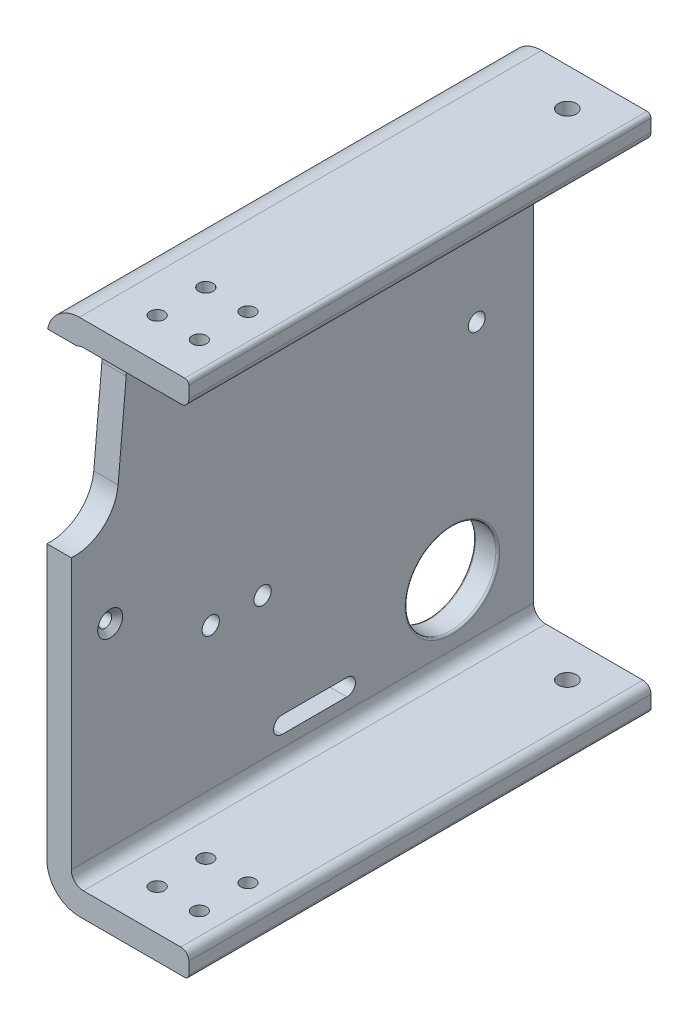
SolidWorks part; units mm, degrees
ref_plane "Plane1" through (0, 0, 0) normal (0, 0, 1) x (1, 0, 0)
ref_plane "Plane2" through (0, 0, 0) normal (0, 1, 0) x (1, 0, 0)
ref_plane "Plane3" through (0, 0, 0) normal (1, 0, 0) x (0, 0, -1)
sketch "Sketch1" plane through (0, 0, 0) normal (0, 0, 1) x (1, 0, 0)
  line L0 (0, -88.9) -> (0, 88.9)
  line L1 (12.7, 101.6) -> (53.975, 101.6)
  line L2 (55.5625, 100.0125) -> (55.5625, 95.25)
  line L3 (52.3875, 92.075) -> (14.2875, 92.075)
  line L4 (9.525, 87.3125) -> (9.525, -87.3125)
  line L5 (14.2875, -92.075) -> (52.3875, -92.075)
  line L6 (55.5625, -95.25) -> (55.5625, -100.0125)
  line L7 (53.975, -101.6) -> (12.7, -101.6)
  arc A0 (12.7, 101.6) -> (0, 88.9) centre (12.7, 88.9) ccw
  arc A1 (0, -88.9) -> (12.7, -101.6) centre (12.7, -88.9) ccw
  arc A2 (9.525, -87.3125) -> (14.2875, -92.075) centre (14.2875, -87.3125) ccw
  arc A3 (14.2875, 92.075) -> (9.525, 87.3125) centre (14.2875, 87.3125) ccw
  arc A4 (55.5625, 95.25) -> (52.3875, 92.075) centre (52.3875, 95.25) cw
  arc A5 (55.5625, -95.25) -> (52.3875, -92.075) centre (52.3875, -95.25) ccw
  arc A6 (55.5625, 100.0125) -> (53.975, 101.6) centre (53.975, 100.0125) ccw
  arc A7 (55.5625, -100.0125) -> (53.975, -101.6) centre (53.975, -100.0125) cw
  dimension "D7" = 12.7
  dimension "D8" = 4.7625
  dimension "D9" = 3.175
  dimension "D10" = 1.5875
  dimension "D2" = 203.2
  dimension "D4" = 9.525
  dimension "D6" = 9.525
  dimension "D11" = 9.525
  dimension "D12" = 55.5625
  dimension "D13" = 55.5625
extrude "Base-Extrude" add sketch "Sketch1" along normal blind 180.975
sketch "Sketch2" plane through (0, 101.6, 0) normal (0, 1, 0) x (-1, 0, 0)
  line L0 (0, 180.975) -> (0, 0) construction
  line L3 (-53.975, 180.975) -> (-12.7, 180.975) construction
  circle A0 centre (-46.482, 155.575) radius 3.3147 construction
  circle A1 centre (-21.082, 155.575) radius 3.3147 construction
  circle A2 centre (-43.7933, 165.1) radius 2.794
  circle A3 centre (-43.7933, 146.05) radius 2.794
  dimension "D4" = 6.6294
  dimension "D1" = 21.082
  dimension "D2" = 5.588
  dimension "D7" = 19.05
  dimension "D3" = 25.4
  dimension "D5" = 25.4
extrude "frame mount holes" cut sketch "Sketch2" against normal through all
sketch "Sketch3" plane through (9.525, 0, 0) normal (1, 0, 0) x (0, 0, -1)
  line L0 (-180.975, -87.3125) -> (-180.975, 87.3125) construction
  circle A0 centre (-22.225, 19.05) radius 3.3147
  dimension "D1" = 6.6294
  dimension "D2" = 158.75
  dimension "D4" = 19.05
extrude "ROD END" cut sketch "Sketch3" against normal through all
chamfer "Chamfer1" [suppressed] distance 3.175 angle 49
sketch "Sketch4" plane through (0, 0, 0) normal (-1, 0, 0) x (0, 0, 1)
  line L0 (180.975, 88.9) -> (180.975, -88.9) construction
  line L1 (98.425, 76.0603) -> (73.025, 76.0603)
  line L2 (98.425, 82.6897) -> (73.025, 82.6897)
  line L3 (0, 0) -> (-21.8116, 0) construction
  line L4 (98.425, -76.0603) -> (73.025, -76.0603)
  line L5 (98.425, -82.6897) -> (73.025, -82.6897)
  arc A0 (98.425, 76.0603) -> (98.425, 82.6897) centre (98.425, 79.375) ccw
  arc A1 (98.425, -82.6897) -> (98.425, -76.0603) centre (98.425, -79.375) ccw
  arc A2 (73.025, 82.6897) -> (73.025, 76.0603) centre (73.025, 79.375) ccw
  arc A3 (73.025, -82.6897) -> (73.025, -76.0603) centre (73.025, -79.375) cw
  dimension "D1" = 82.55
  dimension "D2" = 25.4
  dimension "D4" = 3.3147
  dimension "D3" = 79.375
extrude "U-BOLT" cut sketch "Sketch4" against normal blind 13.97
sketch "Sketch5" plane through (0, 101.6, 0) normal (0, 1, 0) x (-1, 0, 0)
  line L0 (-55.5625, 180.975) -> (-55.5625, 0) construction
  line L1 (-53.975, 0) -> (-12.7, 0) construction
  circle A0 centre (-37.5285, 14.732) radius 3.556
  dimension "D1" = 7.112
  dimension "D2" = 18.034
  dimension "D3" = 14.732
extrude "foam mount holes" cut sketch "Sketch5" against normal through all
hole_wizard "CSK for #10 Flat Head Socket Cap Screw1" positions "Sketch7" profile "Sketch6"
sketch "Sketch7" plane through (9.525, 0, 0) normal (1, 0, 0) x (0, 0, -1)
  point P0 (-157.353, -10.033)
sketch "Sketch6" plane through (9.525, -10.033, 157.353) normal (0, 1, 0) x (0, 0, -1)
  line L0 (0, 0) -> (0, 27.0864)
  line L1 (0, 27.0864) -> (2.8067, 25.4)
  line L2 (2.8067, 25.4) -> (2.8067, 2.7758)
  line L3 (2.8067, 2.7758) -> (5.2197, 0)
  line L5 (5.2197, 0) -> (0, 0)
  line L6 (-2.8067, 2.7758) -> (-5.2197, 0) construction
  line L10 (0, 27.0864) -> (-2.8067, 25.4) construction
  line L11 (0, -6.35) -> (0, 107.95) construction
  dimension "Hole Dia." = 5.6134
  dimension "Hole Depth" = 25.4
  dimension "Near C'Sink Dia." = 10.4394
  dimension "Near C'Sink Angle" = 82
  dimension "Drill Angle" = 118
sketch "Sketch8" plane through (0, 0, 0) normal (-1, 0, 0) x (0, 0, 1)
  line L0 (0, -87.3125) -> (0, 87.3125) construction
  line L1 (180.975, 101.6) -> (0, 101.6) construction
  line L2 (180.975, -101.6) -> (0, -101.6) construction
  circle A0 centre (31.75, -63.5) radius 17.78
  circle A1 centre (50.8, 69.85) radius 13.97
  dimension "D1" = 35.56
  dimension "D2" = 27.94
  dimension "D3" = 50.8
  dimension "D4" = 31.75
  dimension "D5" = 31.75
  dimension "D6" = 38.1
extrude "Cut-Extrude1" cut sketch "Sketch8" against normal through all
fillet "Fillet1" radius 0.762
hole_wizard "Hole1" positions "Sketch9" profile "Sketch10"
sketch "Sketch9" plane through (9.525, -15.7425, 13.4225) normal (1, 0, 0) x (0, 0, -1)
  point P0 (-159.4245, 2.4075)
sketch "Sketch10" plane through (9.525, -13.335, 172.847) normal (0, 1, 0) x (0, 0, -1)
  line L0 (0, 0) -> (0, 27.0864)
  line L1 (0, 27.0864) -> (2.8067, 25.4)
  line L2 (2.8067, 25.4) -> (2.8067, 2.7758)
  line L3 (2.8067, 2.7758) -> (5.2197, 0)
  line L5 (5.2197, 0) -> (0, 0)
  line L6 (-2.8067, 2.7758) -> (-5.2197, 0) construction
  line L10 (0, 27.0864) -> (-2.8067, 25.4) construction
  line L11 (0, -6.35) -> (0, 107.95) construction
  dimension "Hole Dia." = 5.6134
  dimension "Hole Depth" = 25.4
  dimension "Near C'Sink Dia." = 10.4394
  dimension "Near C'Sink Angle" = 82
  dimension "Drill Angle" = 118
sketch "Sketch11" plane through (0, 101.6, 0) normal (0, 1, 0) x (-1, 0, 0)
  circle A0 centre (-27.2833, 146.05) radius 2.8067 construction
  circle A1 centre (-27.2833, 165.1) radius 2.8067 construction
  circle A2 centre (-27.2833, 146.05) radius 2.8067
  circle A3 centre (-27.2833, 165.1) radius 2.8067
extrude "Cut-Extrude2" cut sketch "Sketch11" against normal through all
hole_wizard "CSK for #10 Flat Head Machine Screw (100)1" positions "Sketch14" profile "Sketch13" countersink size "#10" standard "Ansi Inch"
sketch "Sketch14" plane through (9.525, 0, 0) normal (1, 0, 0) x (0, 0, -1)
  line L1 (-180.975, -87.3125) -> (-180.975, 87.3125) construction
  line L2 (-180.975, -101.6) -> (0, -101.6) construction
  point P0 (-165.735, -11.43)
  dimension "D1" = 90.17
  dimension "D2" = 15.24
sketch "Sketch13" plane through (9.525, -11.43, 165.735) normal (0, 1, 0) x (0, 0, -1)
  line L0 (0, 0) -> (0, 9.525)
  line L1 (0, 9.525) -> (2.5527, 9.525)
  line L2 (2.5527, 9.525) -> (2.5527, 1.9608)
  line L3 (2.5527, 1.9608) -> (4.8895, 0)
  line L5 (4.8895, 0) -> (0, 0)
  line L6 (-2.5527, 1.9608) -> (-4.8895, 0) construction
  line L11 (0, -6.35) -> (0, 107.95) construction
  dimension "Thru Hole Dia." = 5.1054
  dimension "Thru Hole Depth" = 9.525
  dimension "Near C'Sink Dia." = 9.779
  dimension "Near C'Sink Angle" = 100
sketch "Sketch15" plane through (9.525, 0, 0) normal (1, 0, 0) x (0, 0, -1)
  line L0 (-179.705, 8.3533) -> (-179.705, 117.3705) construction
  line L1 (-180.975, -87.3125) -> (-180.975, 87.3125) construction
  line L2 (-180.975, 101.6) -> (0, 101.6) construction
  line L3 (-199.9438, 69.3057) -> (-196.7815, 34.0292)
  line L4 (-159.4662, 69.3057) -> (-162.6285, 34.0292)
  arc A0 (-196.7815, 34.0292) -> (-162.6285, 34.0292) centre (-179.705, 35.56) ccw
  arc A1 (-159.4662, 69.3057) -> (-199.9438, 69.3057) centre (-179.705, 71.12) ccw
  dimension "D3" = 35.56
  dimension "D4" = 40.64
  dimension "D5" = 34.29
  dimension "D1" = 1.27
  dimension "D2" = 30.48
extrude "Cut-Extrude3" cut sketch "Sketch15" against normal through all and the other way through all
sketch "Sketch16" plane through (9.525, 0, 0) normal (1, 0, 0) x (0, 0, -1)
  line L0 (-180.975, -87.3125) -> (-180.975, 18.4621) construction
  line L1 (-180.975, -101.6) -> (0, -101.6) construction
  line L2 (-126.365, -31.75) -> (-106.045, -31.75) construction
  circle A0 centre (-126.365, -31.75) radius 3.3782
  circle A1 centre (-106.045, -31.75) radius 3.3782
  dimension "D2" = 6.7564
  dimension "D1" = 54.61
  dimension "D3" = 69.85
  dimension "D4" = 20.32
extrude "Cut-Extrude4" cut sketch "Sketch16" against normal through all
